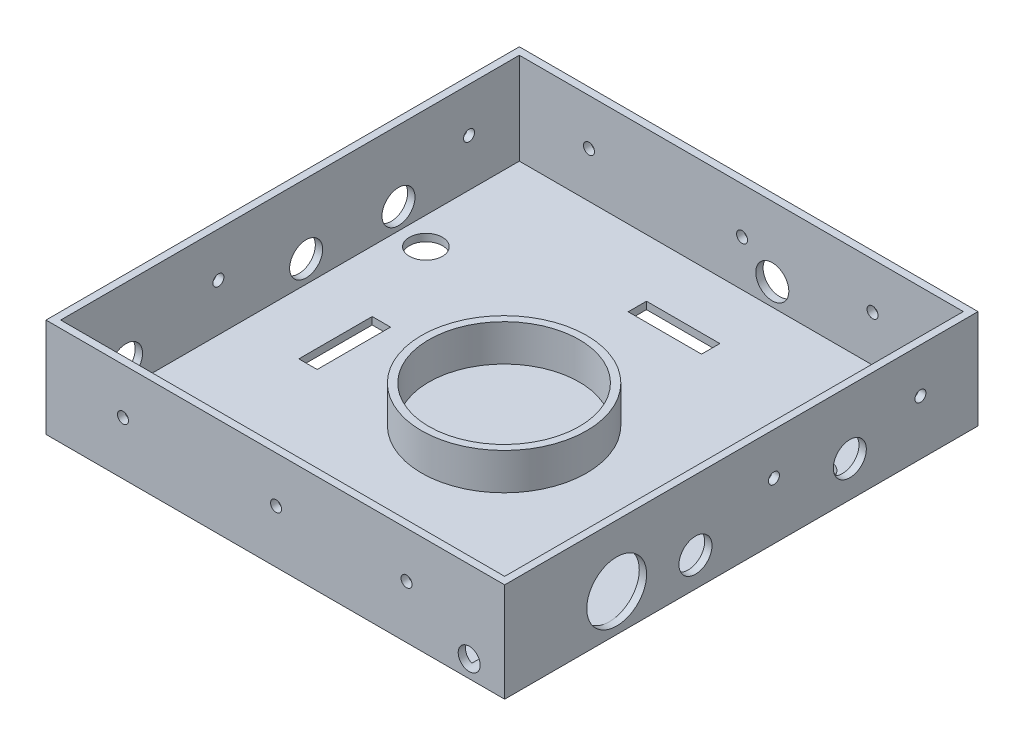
SolidWorks part; units mm, degrees
ref_plane "前视基准面" through (0, 0, 0) normal (0, 0, 1) x (1, 0, 0)
ref_plane "上视基准面" through (0, 0, 0) normal (0, 1, 0) x (1, 0, 0)
ref_plane "右视基准面" through (0, 0, 0) normal (1, 0, 0) x (0, 0, -1)
other "Configuration Table"
sketch "草图1" plane through (0, 0, 0) normal (0, 1, 0) x (1, 0, 0)
  line L1 (0, 0) -> (100, 0)
  line L2 (0, 0) -> (0, 100)
  line L3 (0, 100) -> (100, 100)
  line L4 (100, 0) -> (100, 100)
  dimension "D1" = 100
  dimension "D2" = 100
extrude "凸台-拉伸1" add sketch "草图1" along normal blind 2
sketch "草图2" plane through (0, 2, 0) normal (0, 1, 0) x (1, 0, 0)
  line L0 (0, 0) -> (100, 100)
  line L2 (-55, -55) -> (155, -55)
  line L3 (-55, -55) -> (-55, 155)
  line L4 (-55, 155) -> (155, 155)
  line L5 (155, -55) -> (155, 155)
  line L6 (-55, -55) -> (155, 155) construction
  line L7 (-55, 155) -> (155, -55) construction
  point P4 (50, 50)
  dimension "D1" = 210
  dimension "D2" = 210
extrude "凸台-拉伸2" add sketch "草图2" against normal blind 3 contours L2 L5 L4 L3 M3 M6 M5 M4
sketch "草图3" plane through (0, -1, 0) normal (0, -1, 0) x (1, 0, 0)
  line L1 (-55, 55) -> (155, 55)
  line L2 (-55, 55) -> (-55, -155)
  line L3 (-55, -155) -> (155, -155)
  line L4 (155, 55) -> (155, -155)
extrude "切除-拉伸1" cut sketch "草图3" against normal blind 1
sketch "草图4" plane through (0, 2, 0) normal (0, 1, 0) x (1, 0, 0)
  line L1 (-55, -55) -> (85, -55)
  line L2 (-55, -55) -> (-55, 85)
  line L3 (-55, 85) -> (85, 85)
  line L4 (85, -55) -> (85, 85)
  line L5 (-55, -55) -> (155, -55)
  line L6 (-55, -55) -> (-55, 155)
  line L7 (-55, 155) -> (155, 155)
  line L8 (155, -55) -> (155, 155)
  dimension "D1" = 140
  dimension "D2" = 140
extrude "切除-拉伸3" cut sketch "草图4" against normal blind 2 contours L4 L3 M3 M4 M5 M6
sketch "草图6" plane through (0, 2, 0) normal (0, 1, 0) x (1, 0, 0)
  line L1 (-55, -55) -> (70, -55)
  line L2 (-55, -55) -> (-55, 74)
  line L3 (-55, 74) -> (70, 74)
  line L4 (70, -55) -> (70, 74)
  line L5 (-55, -55) -> (85, -55)
  line L6 (-55, -55) -> (-55, 85)
  line L7 (-55, 85) -> (85, 85)
  line L8 (85, -55) -> (85, 85)
  dimension "D1" = 125
  dimension "D2" = 129
extrude "切除-拉伸4" cut sketch "草图6" against normal blind 2 contours L4 L3 M10 M7 M8 M9
sketch "草图8" plane through (0, 2, 0) normal (0, 1, 0) x (1, 0, 0)
  circle A0 centre (7.2975, 7.5476) radius 20.5
  circle A1 centre (7.2975, 7.5476) radius 22.5
extrude "凸台-拉伸3" add sketch "草图8" along normal blind 10 contours A1
sketch "草图9" plane through (0, 12, 0) normal (0, 1, 0) x (1, 0, 0)
  circle A0 centre (7.2975, 7.5476) radius 20.5
extrude "切除-拉伸5" cut sketch "草图9" against normal blind 10
sketch "草图10" plane through (0, 2, 0) normal (0, 1, 0) x (1, 0, 0)
  line L0 (70, 74) -> (-55, -55)
  line L2 (-53, -53) -> (68, -53)
  line L3 (-53, -53) -> (-53, 72)
  line L4 (-53, 72) -> (68, 72)
  line L5 (68, -53) -> (68, 72)
  line L6 (-53, -53) -> (68, 72) construction
  line L7 (-53, 72) -> (68, -53) construction
  line L8 (-55, 74) -> (70, 74)
  line L9 (-55, 74) -> (-55, -55)
  line L10 (-55, -55) -> (70, -55)
  line L11 (70, 74) -> (70, -55)
  point P2 (7.5, 9.5)
  dimension "D1" = 121
  dimension "D2" = 125
extrude "凸台-拉伸4" add sketch "草图10" along normal blind 25 contours L5 L0 L3 L4 M11 M12 | L5 L2 L3 L0 M13 M10
sketch "草图11" plane through (70, 0, 0) normal (1, 0, 0) x (0, 0, -1)
  circle A0 centre (-24.4689, 10.1813) radius 8.154
  circle A1 centre (-2.9905, 8) radius 4.5
  circle A2 centre (39.0672, 9.7514) radius 4.5
  circle A3 centre (39.0672, 7.7514) radius 2 construction
extrude "切除-拉伸6" cut sketch "草图11" against normal blind 25
sketch "草图12" plane through (-55, 0, 0) normal (-1, 0, 0) x (0, 0, 1)
  circle A0 centre (35.1903, 8.022) radius 4.5
  circle A1 centre (-13.8932, 8) radius 4.5
  circle A2 centre (-39.0672, 7.7514) radius 4.5
extrude "切除-拉伸7" cut sketch "草图12" against normal blind 25
sketch "草图13" plane through (0, 0, -74) normal (0, 0, -1) x (-1, 0, 0)
  circle A0 centre (-15.9382, 8) radius 4.5
extrude "切除-拉伸8" cut sketch "草图13" against normal blind 25
sketch "草图14" plane through (0, 0, 0) normal (0, -1, 0) x (1, 0, 0)
  circle A0 centre (60.1353, -39.0518) radius 4.5
  circle A1 centre (-45.5255, -39.0672) radius 4.5
extrude "切除-拉伸9" cut sketch "草图14" against normal blind 25
sketch "草图15" plane through (0, 2, 0) normal (0, 1, 0) x (1, 0, 0)
  line L1 (-2.6234, 56.2738) -> (17.3766, 56.2738)
  line L2 (-2.6234, 56.2738) -> (-2.6234, 51.2738)
  line L3 (-2.6234, 51.2738) -> (17.3766, 51.2738)
  line L4 (17.3766, 56.2738) -> (17.3766, 51.2738)
  dimension "D1" = 20
  dimension "D2" = 5
extrude "切除-拉伸10" cut sketch "草图15" against normal blind 25
sketch "草图16" plane through (0, 0, 55) normal (0, 0, 1) x (1, 0, 0)
  circle A0 centre (7.7, 14.4581) radius 1.5
  circle A1 centre (-34.0183, 14.4581) radius 1.5
  circle A2 centre (43.2593, 14.4581) radius 1.5
extrude "切除-拉伸11" cut sketch "草图16" against normal blind 142
sketch "草图17" plane through (-55, 0, 0) normal (-1, 0, 0) x (0, 0, 1)
  circle A0 centre (-58.3043, 14.9117) radius 1.5
  circle A1 centre (10.009, 14.9117) radius 1.5
extrude "切除-拉伸12" cut sketch "草图17" against normal blind 98
sketch "草图18" plane through (70, 0, 0) normal (1, 0, 0) x (0, 0, -1)
  circle A0 centre (18.3932, 15.4757) radius 1.5
  circle A1 centre (58.3043, 14.9117) radius 1.5
extrude "切除-拉伸13" cut sketch "草图18" against normal blind 98
sketch "草图19" plane through (0, 2, 0) normal (0, 1, 0) x (1, 0, 0)
  line L0 (46.9594, 16.2246) -> (51.9594, 16.2246)
  line L1 (-36.3843, 15.2815) -> (-31.3843, 15.2815)
  line L2 (-36.3843, 15.2815) -> (-36.3843, -4.7185)
  line L3 (-36.3843, -4.7185) -> (-31.3843, -4.7185)
  line L4 (-31.3843, 15.2815) -> (-31.3843, -4.7185)
  line L5 (46.9594, 16.2246) -> (46.9594, -3.7754)
  line L6 (46.9594, -3.7754) -> (51.9594, -3.7754)
  line L7 (51.9594, 16.2246) -> (51.9594, -3.7754)
  dimension "D1" = 5
  dimension "D2" = 20
extrude "切除-拉伸14" cut sketch "草图19" against normal blind 98 contours L0 L7 L6 L5 | L2 L1 L4 L3
sketch "草图20" plane through (0, 0, 55) normal (0, 0, 1) x (1, 0, 0)
  circle A0 centre (60.3354, 4.6945) radius 3
extrude "切除-拉伸15" cut sketch "草图20" against normal blind 10
